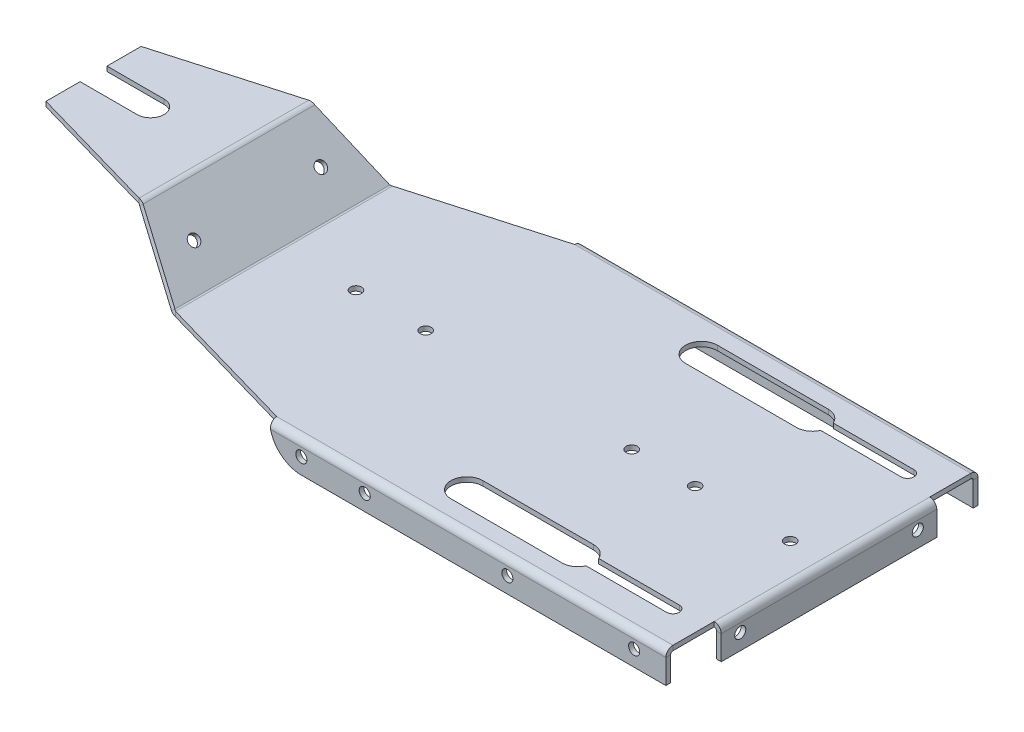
SolidWorks part; units mm, degrees
ref_plane "Front Plane" through (0, 0, 0) normal (0, 0, 1) x (1, 0, 0)
ref_plane "Top Plane" through (0, 0, 0) normal (0, 1, 0) x (1, 0, 0)
ref_plane "Right Plane" through (0, 0, 0) normal (1, 0, 0) x (0, 0, -1)
sketch "Sketch1" plane through (0, 0, 0) normal (0, 1, 0) x (1, 0, 0)
  line L0 (0, 0) -> (0, 23)
  line L1 (0, 23) -> (10, 23)
  line L2 (10, 23) -> (10, 91)
  line L3 (10, 91) -> (0, 91)
  line L4 (0, 91) -> (0, 114)
  line L5 (0, 114) -> (-115, 114)
  line L6 (0, 0) -> (-115, 0)
  line L7 (5, 91) -> (5, 23) construction
  line L8 (10, 57) -> (-237, 57) construction
  line L9 (-237, 61.25) -> (-237, 72)
  line L10 (-237, 72) -> (-125, 104)
  line L11 (-237, 52.75) -> (-237, 42)
  line L12 (-237, 42) -> (-125, 10)
  line L13 (-115, 114) -> (-115, 0) construction
  line L14 (0, 109) -> (-115, 109) construction
  line L15 (-219, 61.25) -> (-237, 61.25)
  line L16 (-219, 52.75) -> (-237, 52.75)
  line L17 (-182, 87.7143) -> (-182, 26.2857) construction
  line L18 (-125, 104) -> (-125, 57) construction
  line L19 (-75, 20) -> (-40, 20) construction
  line L20 (-75, 25) -> (-40, 25)
  line L21 (-75, 15) -> (-40, 15)
  line L22 (-40, 20) -> (0, 20) construction
  line L23 (-10, 22) -> (-10, 18) construction
  line L24 (-10, 22) -> (-35.4174, 22)
  line L25 (-10, 18) -> (-35.4174, 18)
  line L26 (-75, 99) -> (-40, 99)
  line L27 (-10, 96) -> (-35.4174, 96)
  line L28 (-10, 92) -> (-35.4174, 92)
  line L29 (-75, 89) -> (-40, 89)
  circle A0 centre (5, 29) radius 1.75
  circle A1 centre (5, 85) radius 1.75
  arc A2 (-115, 114) -> (-125, 104) centre (-115, 104) ccw
  arc A3 (-125, 10) -> (-115, 0) centre (-115, 10) ccw
  circle A4 centre (-10, 109) radius 1.75
  circle A5 centre (-50, 109) radius 1.75
  circle A6 centre (-95, 109) radius 1.75
  circle A7 centre (-115, 109) radius 1.75
  circle A8 centre (-10, 5) radius 1.75
  circle A9 centre (-50, 5) radius 1.75
  circle A10 centre (-95, 5) radius 1.75
  circle A11 centre (-115, 5) radius 1.75
  arc A12 (-219, 52.75) -> (-219, 61.25) centre (-219, 57) ccw
  circle A13 centre (-182, 77) radius 1.75
  circle A14 centre (-182, 37) radius 1.75
  circle A15 centre (-125, 57) radius 1.75
  circle A16 centre (-147, 57) radius 1.75
  circle A17 centre (-60, 57) radius 1.75
  circle A18 centre (-40, 57) radius 1.75
  circle A19 centre (-10, 57) radius 1.75
  arc A20 (-75, 25) -> (-75, 15) centre (-75, 20) ccw
  arc A21 (-40, 15) -> (-35.4174, 18) centre (-40, 20) ccw
  arc A22 (-10, 18) -> (-10, 22) centre (-10, 20) ccw
  arc A23 (-35.4174, 22) -> (-40, 25) centre (-40, 20) ccw
  arc A24 (-75, 89) -> (-75, 99) centre (-75, 94) cw
  arc A25 (-40, 99) -> (-35.4174, 96) centre (-40, 94) cw
  arc A26 (-10, 96) -> (-10, 92) centre (-10, 94) cw
  arc A27 (-35.4174, 92) -> (-40, 89) centre (-40, 94) cw
  dimension "D5" = 6
  dimension "D6" = 6
  dimension "D7" = 3.5
  dimension "D8" = 20
  dimension "D9" = 20
  dimension "D18" = 40
  dimension "D19" = 45
  dimension "D20" = 20
  dimension "D10" = 8.5
  dimension "D25" = 10
  dimension "D26" = 20
  dimension "D27" = 30
  dimension "D28" = 22
  dimension "D29" = 20
  dimension "D30" = 20
  dimension "D32" = 5
  dimension "D34" = 50
  dimension "D35" = 35
  dimension "D36" = 4
  dimension "D37" = 10
  dimension "D38" = 5
  dimension "D1" = 10
  dimension "D2" = 23
  dimension "D3" = 23
  dimension "D4" = 68
  dimension "D11" = 30
  dimension "D12" = 10
  dimension "D13" = 10
  dimension "D14" = 125
  dimension "D15" = 125
  dimension "D16" = 5
  dimension "D17" = 10
  dimension "D21" = 18
  dimension "D22" = 247
  dimension "D23" = 247
  dimension "D24" = 15
  dimension "D31" = 55
  dimension "D33" = 20
  dimension "D39" = 10
  dimension "D40" = 5
sheet metal parameters "Sheet-Metal1" thickness 1.5 parameters "D1"=0.7366
base flange "Base-Flange1" sketch "Sketch1" thickness 1.5 reverse thickness direction no parameters "D1"=0.7366
sketch "Sketch2" plane through (0, 0, 0) normal (0, 1, 0) x (1, 0, 0)
  line L0 (-195, 84) -> (-195, 30)
  line L1 (-125, 104) -> (-237, 72) construction
  line L2 (-237, 42) -> (-125, 10) construction
  line L3 (-237, 72) -> (-237, 61.25) construction
  dimension "D1" = 42
sketched bend "Sketched Bend1" parameters "D1"=0.7366
bend "SketchBend1" bend radius 0.7366 bend angle 45 parameters "D5"=1
sketch "Sketch3" plane through (0, 0, 0) normal (0, 1, 0) x (1, 0, 0)
  line L0 (-170, 91.1429) -> (-170, 22.8571)
  line L1 (-125, 104) -> (-194.6949, 84.0872) construction
  line L2 (-194.6949, 29.9128) -> (-125, 10) construction
  circle A0 centre (-182, 37) radius 1.75 construction
  dimension "D1" = 12
sketched bend "Sketched Bend2" parameters "D1"=0.7366
bend "SketchBend2" bend radius 0.7366 bend angle 45 parameters "D5"=2
sketch "Sketch4" plane through (0, 0, 0) normal (0, 1, 0) x (1, 0, 0)
  line L0 (-125, 104) -> (0, 104)
  line L1 (0, 91) -> (0, 114) construction
  line L2 (0, 91) -> (0, 23)
  line L3 (-125, 10) -> (0, 10)
  line L4 (0, 0) -> (0, 23) construction
sketched bend "Sketched Bend6" parameters "D1"=0.7366
bend "SketchBend9" bend radius 0.7366 bend angle 90 parameters "D5"=3
bend "SketchBend10" bend radius 0.7366 bend angle 90 parameters "D5"=4
bend "SketchBend11" bend radius 0.7366 bend angle 90 parameters "D5"=5
flat pattern "Flat-Pattern1"
sketch "Bend-Lines1" plane through (0, 0, 0) normal (0, 1, 0) x (-1, 0, 0)
bend of the flat pattern "Flatten-<SketchBend1>1"
bend of the flat pattern "Flatten-<SketchBend2>1"
bend of the flat pattern "Flatten-<SketchBend9>1"
bend of the flat pattern "Flatten-<SketchBend10>1"
bend of the flat pattern "Flatten-<SketchBend11>1"
